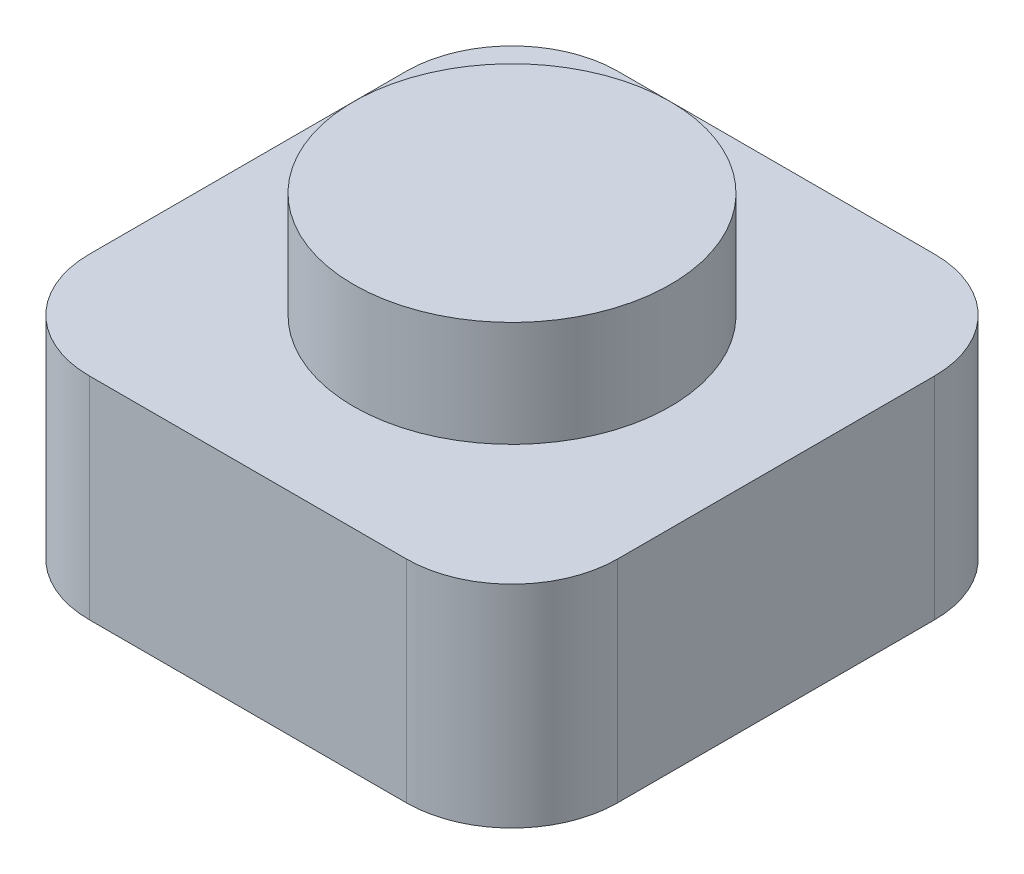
SolidWorks part; units mm, degrees
ref_plane "前视基准面" through (0, 0, 0) normal (0, 0, 1) x (1, 0, 0)
ref_plane "上视基准面" through (0, 0, 0) normal (0, 1, 0) x (1, 0, 0)
ref_plane "右视基准面" through (0, 0, 0) normal (1, 0, 0) x (0, 0, -1)
other "Configuration Table"
sketch "草图1" plane through (0, 0, 0) normal (0, 1, 0) x (1, 0, 0)
  line L1 (-3.9917, -6.7562) -> (2.0083, -6.7562)
  line L2 (-5.9917, -4.7562) -> (-5.9917, 1.2438)
  line L3 (-3.9917, 3.2438) -> (2.0083, 3.2438)
  line L4 (4.0083, -4.7562) -> (4.0083, 1.2438)
  line L5 (-5.9917, -6.7562) -> (4.0083, 3.2438) construction
  line L6 (-5.9917, 3.2438) -> (4.0083, -6.7562) construction
  arc A0 (4.0083, 1.2438) -> (2.0083, 3.2438) centre (2.0083, 1.2438) ccw
  arc A1 (2.0083, -6.7562) -> (4.0083, -4.7562) centre (2.0083, -4.7562) ccw
  arc A2 (-5.9917, -4.7562) -> (-3.9917, -6.7562) centre (-3.9917, -4.7562) ccw
  arc A3 (-5.9917, 1.2438) -> (-3.9917, 3.2438) centre (-3.9917, 1.2438) cw
  point P0 (-0.9917, -1.7562)
  dimension "D3" = 2
  dimension "D1" = 10
  dimension "D2" = 10
extrude "凸台-拉伸1" add sketch "草图1" along normal blind 4
sketch "草图2" plane through (0, 4, 0) normal (0, 1, 0) x (1, 0, 0)
  line L0 (2.0083, 3.2438) -> (-3.9917, 3.2438) construction
  line L1 (4.0083, -4.7562) -> (4.0083, 1.2438) construction
  circle A0 centre (-0.9917, -1.7562) radius 3
  point P4 (-0.9917, 3.2438)
  point P7 (4.0083, -1.7562)
  dimension "D1" = 6
extrude "凸台-拉伸2" add sketch "草图2" along normal blind 2
